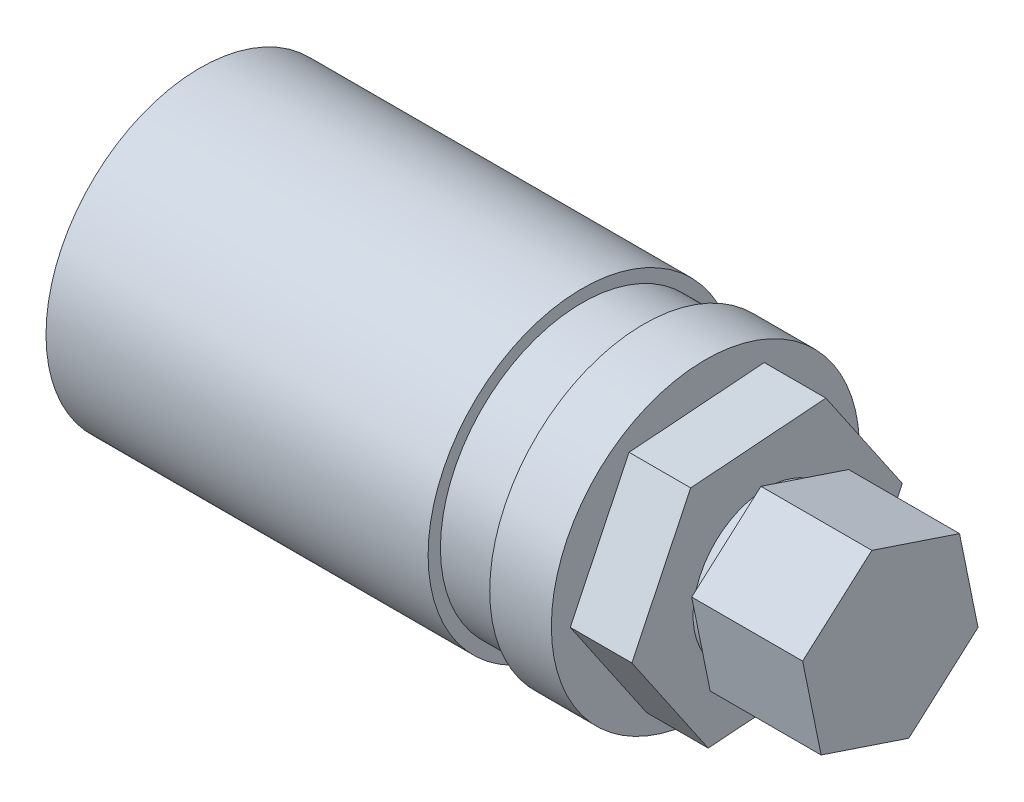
SolidWorks part; units mm, degrees
ref_plane "Alzado" through (0, 0, 0) normal (0, 0, 1) x (1, 0, 0)
ref_plane "Planta" through (0, 0, 0) normal (0, 1, 0) x (1, 0, 0)
ref_plane "Vista lateral" through (0, 0, 0) normal (1, 0, 0) x (0, 0, -1)
sketch "Croquis1" plane through (0, 0, 0) normal (0, 0, 1) x (1, 0, 0)
  line L0 (0, 0) -> (33.7038, 0) construction
  line L1 (0, 0) -> (0, 12.5)
  line L2 (0, 12.5) -> (31, 12.5)
  line L3 (31, 12.5) -> (31, 11.5)
  line L4 (31, 11.5) -> (36, 11.5)
  line L5 (36, 11.5) -> (36, 12.5)
  line L6 (36, 12.5) -> (41, 12.5)
  line L7 (41, 12.5) -> (41, 0)
  line L8 (41, 0) -> (0, 0)
  dimension "D1" = 25
  dimension "D2" = 1
  dimension "D3" = 31
  dimension "D4" = 5
revolve "Revolución1" add sketch "Croquis1" angle 360 about L0
sketch "Croquis2" plane through (41, 0, 0) normal (1, 0, 0) x (0, 0, -1)
  line L7 (-6.1971, 9.0882) -> (-10.9692, -0.8227)
  line L8 (-10.9692, -0.8227) -> (-4.7721, -9.911)
  line L9 (-4.7721, -9.911) -> (6.1971, -9.0882)
  line L10 (6.1971, -9.0882) -> (10.9692, 0.8227)
  line L11 (10.9692, 0.8227) -> (4.7721, 9.911)
  line L12 (4.7721, 9.911) -> (-6.1971, 9.0882)
  circle A0 centre (0, 0) radius 9.5263 construction
  dimension "D1" = 22
extrude "Saliente-Extruir1" add sketch "Croquis2" along normal blind 5
sketch "Croquis3" plane through (46, 0, 0) normal (1, 0, 0) x (0, 0, -1)
  circle A0 centre (0, 0) radius 6
  dimension "D1" = 12
extrude "Saliente-Extruir2" add sketch "Croquis3" along normal blind 1
sketch "Croquis4" plane through (47, 0, 0) normal (1, 0, 0) x (0, 0, -1)
  line L1 (-1.4982, 7.3488) -> (-7.1134, 2.377)
  line L2 (-7.1134, 2.377) -> (-5.6152, -4.9719)
  line L3 (-5.6152, -4.9719) -> (1.4982, -7.3488)
  line L4 (1.4982, -7.3488) -> (7.1134, -2.377)
  line L5 (7.1134, -2.377) -> (5.6152, 4.9719)
  line L6 (5.6152, 4.9719) -> (-1.4982, 7.3488)
  circle A0 centre (0, 0) radius 6.4952 construction
  dimension "D1" = 15
extrude "Saliente-Extruir3" add sketch "Croquis4" along normal blind 9
